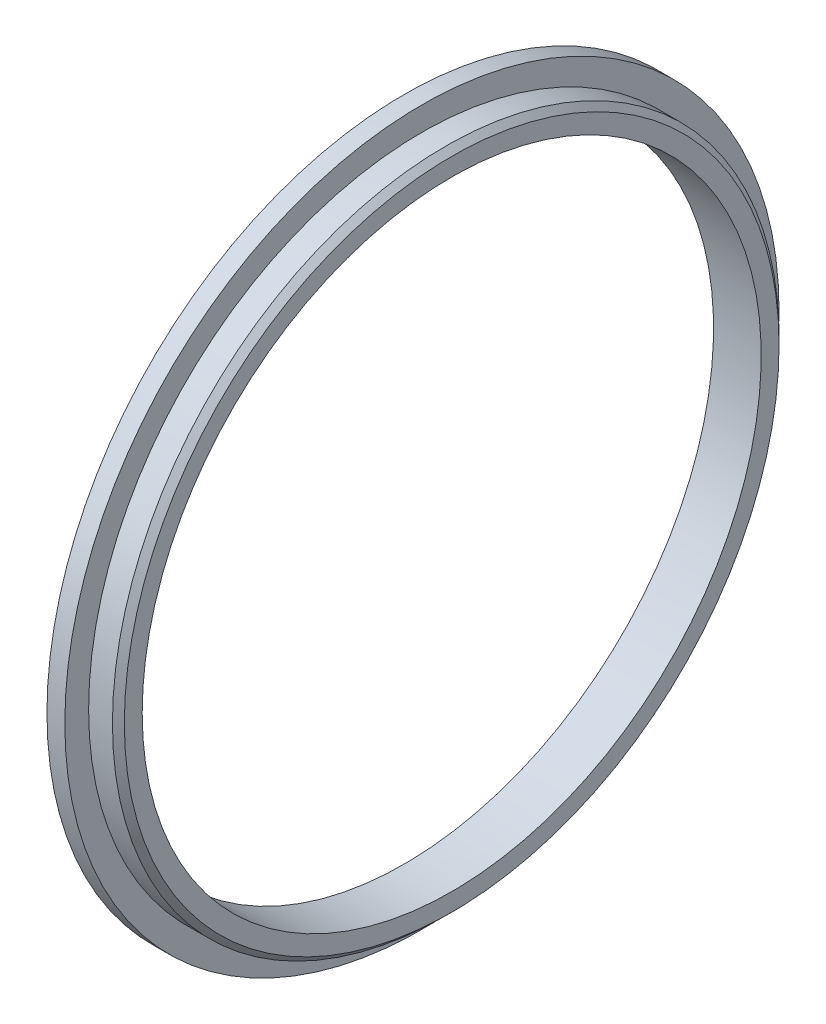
SolidWorks part; units mm, degrees
ref_plane "Plan de face" through (0, 0, 0) normal (0, 0, 1) x (1, 0, 0)
ref_plane "Plan de dessus" through (0, 0, 0) normal (0, 1, 0) x (1, 0, 0)
ref_plane "Plan de droite" through (0, 0, 0) normal (1, 0, 0) x (0, 0, -1)
sketch "Esquisse1" plane through (0, 0, 0) normal (0, 0, 1) x (1, 0, 0)
  line L0 (0, 26) -> (0, 30)
  line L1 (0, 30) -> (1.5, 30)
  line L2 (1.5, 30) -> (1.5, 28)
  line L3 (1.5, 28) -> (3.5, 28)
  line L4 (4, 27.5) -> (4, 26)
  line L6 (0, 26) -> (4, 26)
  line L7 (3.5, 28) -> (4, 27.5)
  line L8 (-1.2334, 0) -> (3.1515, 0) construction
  point P0 (0.75, 30)
  point P6 (4, 28)
  dimension "D1" = 26
  dimension "D2" = 28
  dimension "D3" = 4
  dimension "D4" = 1.5
  dimension "D5" = 30
revolve "Révolution1" add sketch "Esquisse1" angle 360 about L8
